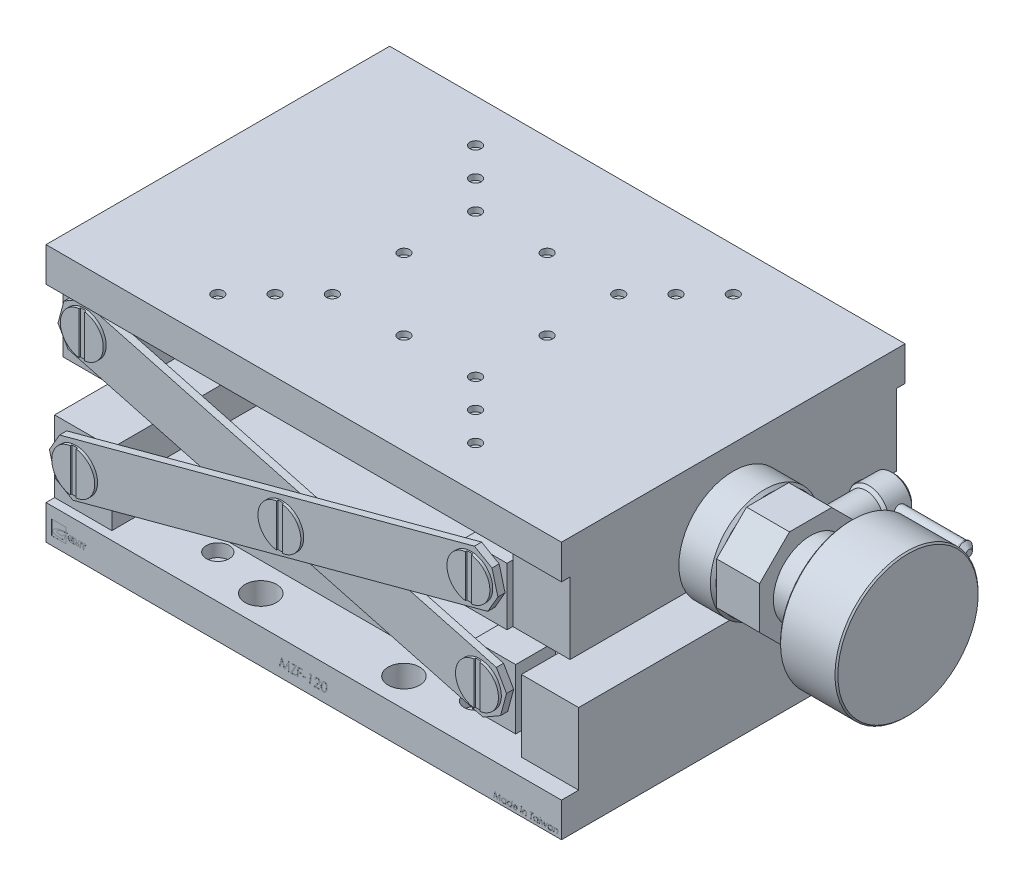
SolidWorks part; units mm, degrees
ref_plane "Front Plane" through (0, 0, 0) normal (0, 0, 1) x (1, 0, 0)
ref_plane "Top Plane" through (0, 0, 0) normal (0, 1, 0) x (1, 0, 0)
ref_plane "Right Plane" through (0, 0, 0) normal (1, 0, 0) x (0, 0, -1)
sketch "Sketch2" plane through (0, 0, 0) normal (0, 0, 1) x (1, 0, 0)
  line L0 (-90, 0) -> (90, 0)
  line L1 (90, 0) -> (90, 12)
  line L4 (90, 12) -> (-90, 12)
  line L7 (-90, 12) -> (-90, 0)
  line L8 (0, 0) -> (0, 56.6665) construction
  dimension "D2" = 12
  dimension "D3" = 180
extrude "Extrude1" add sketch "Sketch2" along normal mid plane 120
sketch "Sketch3" plane through (0, 0, 0) normal (0, 0, 1) x (1, 0, 0)
  line L0 (-90, 90) -> (90, 90)
  line L1 (-90, 90) -> (-90, 78)
  line L2 (-90, 78) -> (90, 78)
  line L7 (90, 78) -> (90, 90)
  line L8 (0, 0) -> (0, 61.872) construction
  line L9 (-90, 12) -> (-90, 0) construction
  dimension "D1" = 12
  dimension "D3" = 90
extrude "Extrude2" add sketch "Sketch3" along normal mid plane 120 separate body
sketch "Sketch5" plane through (0, 0, 0) normal (0, 0, 1) x (1, 0, 0)
  line L0 (-90, 78) -> (90, 78) construction
  line L5 (90, 12) -> (-90, 12) construction
  line L6 (90, 78) -> (90, 90) construction
  line L7 (70, 78) -> (90, 78)
  line L8 (70, 78) -> (70, 53)
  line L9 (70, 53) -> (90, 53)
  line L10 (0, 0) -> (0, 91.9874) construction
  line L11 (90, 78) -> (90, 53)
  line L12 (-90, 12) -> (-90, 0) construction
  line L15 (-90, 37) -> (-90, 12)
  line L16 (-70, 12) -> (-90, 12)
  line L17 (-70, 37) -> (-70, 12)
  line L22 (-70, 37) -> (-90, 37)
  dimension "D1" = 20
  dimension "D2" = 25
  dimension "D3" = 20
  dimension "D4" = 25
extrude "Extrude3" add sketch "Sketch5" against normal mid plane 114
ref_plane "Plane3" through (0, 0, 25) normal (0, 0, 1) x (1, 0, 0)
ref_plane "Plane4" through (0, 0, 35) normal (0, 0, 1) x (1, 0, 0)
sketch "Sketch31" plane through (0, 0, 0) normal (0, 0, 1) x (1, 0, 0)
  line L0 (70, 62.5) -> (116.0682, 62.5) construction
  line L1 (90, 78) -> (90, 90) construction
  line L2 (90, 78) -> (90, 90) construction
  line L3 (90, 90) -> (-90, 90) construction
  line L4 (102, 72) -> (117, 72)
  line L5 (90, 53) -> (90, 78) construction
  line L6 (117, 72) -> (117, 75.5)
  line L7 (117, 75.5) -> (131, 75.5)
  line L8 (131, 75.5) -> (131, 87.5)
  line L9 (131, 87.5) -> (151, 87.5)
  line L10 (151, 87.5) -> (151, 62.5)
  line L12 (90, 62.5) -> (151, 62.5)
  line L14 (90, 81.5) -> (102, 81.5)
  line L15 (90, 81.5) -> (90, 62.5)
  line L17 (102, 81.5) -> (102, 72)
  dimension "D1" = 27.5
  dimension "D2" = 50
  dimension "D3" = 20
  dimension "D4" = 61
  dimension "D5" = 14
  dimension "D6" = 19
  dimension "D7" = 26
  dimension "D8" = 12
  dimension "D9" = 19
revolve "Revolve2" add sketch "Sketch31" angle 360 about L0
chamfer "Chamfer4" distance 0.5 angle 45 2 edges at (131, 62.5, 25) (151, 62.5, 25)
chamfer "Chamfer" distance 1 angle 45 1 edges at (102, 62.5, 19)
ref_plane "Plane5" through (0, 72.5, 0) normal (0, 1, 0) x (-1, 0, 0)
ref_plane "Plane6" through (107, 0, 0) normal (1, 0, 0) x (0, 0, -1)
sketch "Sketch36" plane through (0, 0, 0) normal (0, 0, 1) x (1, 0, 0)
  line L0 (-90, 78) -> (90, 78) construction
  line L1 (-90, 78) -> (-70, 78)
  line L2 (-90, 78) -> (-90, 53)
  line L3 (-90, 53) -> (-70, 53)
  line L4 (-70, 78) -> (-70, 53)
  line L5 (90, 12) -> (70, 12)
  line L6 (90, 12) -> (90, 37)
  line L7 (90, 37) -> (70, 37)
  line L8 (70, 12) -> (70, 37)
  line L9 (90, 12) -> (-90, 12) construction
  dimension "D1" = 20
  dimension "D2" = 25
  dimension "D3" = 25
  dimension "D4" = 20
extrude "Extrude4" add sketch "Sketch36" along normal mid plane 108
sketch "Sketch37" plane through (0, 0, 0) normal (0, 0, 1) x (1, 0, 0)
  line L0 (-70, 53) -> (-70, 78) construction
  line L1 (-70, 65.5) -> (70, 65.5)
  line L2 (-70, 65.5) -> (-70, 78)
  line L3 (-70, 78) -> (70, 78)
  line L4 (70, 65.5) -> (70, 78)
  line L5 (-70, 12) -> (-70, 37) construction
  line L6 (-70, 24.5) -> (70, 24.5)
  line L7 (-70, 24.5) -> (-70, 12)
  line L8 (-70, 12) -> (70, 12)
  line L9 (70, 24.5) -> (70, 12)
  line L10 (90, 12) -> (-90, 12) construction
  line L11 (70, 37) -> (70, 12) construction
extrude "Extrude5" add sketch "Sketch37" along normal mid plane 80
sketch "Sketch38" plane through (0, 0, 25) normal (0, 0, 1) x (1, 0, 0)
  line L0 (25, 102.4031) -> (25, 51.2244) construction
  line L1 (27, 90) -> (27, 88)
  line L2 (90, 90) -> (-90, 90) construction
  line L3 (27, 88) -> (25, 88)
  line L4 (27, 90) -> (25, 90)
  line L5 (25, 90) -> (25, 88)
  dimension "D1" = 25
  dimension "D2" = 2
  dimension "D3" = 4
revolve "Cut-Revolve1" cut sketch "Sketch38" angle 360 about L0
pattern_linear "LPattern1" count 3 spacing 25 along (-1, 0, 0) count 3 spacing 25 along (0, 0, -1) of "Cut-Revolve1"
sketch "Sketch39" plane through (0, 0, 35) normal (0, 0, 1) x (1, 0, 0)
  line L0 (35, 131.6916) -> (35, 44.3084) construction
  line L1 (37, 90) -> (37, 88)
  line L2 (90, 90) -> (-90, 90) construction
  line L3 (37, 88) -> (35, 88)
  line L4 (35, 88) -> (35, 90)
  line L5 (35, 90) -> (37, 90)
  dimension "D1" = 35
  dimension "D2" = 2
  dimension "D3" = 4
revolve "Cut-Revolve2" cut sketch "Sketch39" angle 360 about L0
pattern_linear "LPattern2" count 2 spacing 70 along (0, 0, -1) count 2 spacing 70 along (-1, 0, 0) of "Cut-Revolve2"
ref_plane "Plane7" through (0, 0, 45) normal (0, 0, 1) x (1, 0, 0)
sketch "Sketch40" plane through (0, 0, 45) normal (0, 0, 1) x (1, 0, 0)
  line L0 (45, 116.5119) -> (45, 54.8208) construction
  line L1 (45, 90) -> (47, 90)
  line L2 (90, 90) -> (-90, 90) construction
  line L3 (47, 90) -> (47, 88)
  line L4 (47, 88) -> (45, 88)
  line L5 (45, 88) -> (45, 90)
  dimension "D1" = 45
  dimension "D2" = 2
  dimension "D3" = 4
revolve "Cut-Revolve3" cut sketch "Sketch40" angle 360 about L0
pattern_linear "LPattern3" count 2 spacing 90 along (0, 0, -1) count 2 spacing 90 along (-1, 0, 0) of "Cut-Revolve3"
ref_plane "Plane9" through (0, 0, 50) normal (0, 0, 1) x (1, 0, 0)
sketch "Sketch42" plane through (0, 0, 0) normal (0, 0, 1) x (1, 0, 0)
  line L0 (75, 111.2557) -> (75, -23.1922) construction
  line L1 (80.5, 12) -> (80.5, 3.5)
  line L2 (90, 12) -> (-90, 12) construction
  line L3 (80.5, 3.5) -> (78.5, 3.5)
  line L4 (78.5, 3.5) -> (78.5, 0)
  line L5 (-90, 0) -> (90, 0) construction
  line L6 (78.5, 0) -> (75, 0)
  line L7 (75, 0) -> (75, 12)
  line L8 (75, 12) -> (80.5, 12)
  line L9 (90, 12) -> (90, 37) construction
  dimension "D1" = 15
  dimension "D2" = 3.5
  dimension "D3" = 7
  dimension "D4" = 11
revolve "Cut-Revolve4" cut sketch "Sketch42" angle 360 about L0
pattern_linear "LPattern4" count 4 spacing 50 along (-1, 0, 0) count 2 spacing 50 of "Cut-Revolve4"
pattern_linear "LPattern5" count 2 spacing 50 along (1, 0, 0) count 3 spacing 50 along (-1, 0, 0) of "Cut-Revolve4"
sketch "Sketch43" plane through (0, 0, 45) normal (0, 0, 1) x (1, 0, 0)
  line L0 (45, 111.6861) -> (45, -36.0272) construction
  line L1 (49, 12) -> (49, 7.5)
  line L2 (90, 12) -> (-90, 12) construction
  line L3 (49, 7.5) -> (47.25, 7.5)
  line L4 (47.25, 7.5) -> (47.25, 0)
  line L5 (-90, 0) -> (90, 0) construction
  line L6 (47.25, 0) -> (45, 0)
  line L7 (45, 0) -> (45, 12)
  line L8 (45, 12) -> (49, 12)
  dimension "D1" = 45
  dimension "D2" = 7.5
  dimension "D3" = 8
  dimension "D4" = 2.25
revolve "Cut-Revolve5" cut sketch "Sketch43" angle 360 about L0
pattern_linear "LPattern6" count 2 spacing 90 along (0, 0, -1) count 2 spacing 90 along (-1, 0, 0) of "Cut-Revolve5"
sketch "Sketch44" plane through (102, 0, 0) normal (1, 0, 0) x (0, 0, -1)
  line L0 (0, 62.5) -> (20.571, 62.5) construction
  line L1 (20.571, 62.5) -> (10.2855, 80.315) construction
  line L2 (10.2855, 80.315) -> (-10.2855, 80.315) construction
  line L3 (-10.2855, 80.315) -> (-20.571, 62.5) construction
  line L4 (-20.571, 62.5) -> (-10.2855, 44.685) construction
  line L5 (-10.2855, 44.685) -> (10.2855, 44.685) construction
  line L6 (10.2855, 44.685) -> (20.571, 62.5) construction
  line L8 (7.3792, 80.315) -> (-7.3792, 80.315)
  line L9 (-7.3792, 80.315) -> (-17.815, 69.8792)
  line L10 (-17.815, 69.8792) -> (-17.815, 55.1208)
  line L11 (-17.815, 55.1208) -> (-7.3792, 44.685)
  line L12 (-7.3792, 44.685) -> (7.3792, 44.685)
  line L13 (7.3792, 44.685) -> (17.815, 55.1208)
  line L14 (17.815, 55.1208) -> (17.815, 69.8792)
  line L15 (17.815, 69.8792) -> (7.3792, 80.315)
  circle A0 centre (0, 62.5) radius 17.815 construction
  circle A1 centre (0, 62.5) radius 24.5 construction
  circle A2 centre (0, 62.5) radius 9.5 construction
  circle A3 centre (0, 62.5) radius 9.5
  circle A4 centre (0, 62.5) radius 17.815 construction
  dimension "D1" = 35.63
extrude "Extrude6" add sketch "Sketch44" along normal blind 15
sketch "Sketch45" plane through (0, 0, 40) normal (0, 0, 1) x (1, 0, 0)
  line L0 (70, 37) -> (70, 12) construction
  line L1 (53, 39) -> (68, 39)
  line L2 (53, 39) -> (53, 18)
  line L3 (53, 18) -> (68, 18)
  line L4 (68, 39) -> (68, 18)
  line L5 (90, 12) -> (-90, 12) construction
  line L6 (90, 37) -> (70, 37) construction
  dimension "D1" = 2
  dimension "D2" = 6
  dimension "D3" = 2
  dimension "D4" = 15
extrude "Extrude7" add sketch "Sketch45" along normal blind 14
mirror "Mirror1" about plane through (0, 0, 0) normal (0, 0, 1) of "Extrude7"
sketch "Sketch46" plane through (0, 0, 54) normal (0, 0, 1) x (1, 0, 0)
  line L0 (-11, 48) -> (-11, -18.5173) construction
  line L1 (-90, 78) -> (-90, 53) construction
  line L2 (-98.0547, 71.3262) -> (82.97, 22.8208) construction
  line L3 (90, 12) -> (-90, 12) construction
  line L4 (-85.9447, 77.3989) -> (68.6034, 35.9878)
  line L5 (63.9447, 18.6011) -> (-90.6034, 60.0122)
  line L6 (-90.6034, 60.0122) -> (-85.9447, 77.3989)
  line L7 (63.9447, 18.6011) -> (68.6034, 35.9878)
  dimension "D1" = 79
  dimension "D2" = 15
  dimension "D3" = 48
  dimension "D4" = 18
  dimension "D5" = 80
  dimension "D6" = 80
extrude "Extrude8" add sketch "Sketch46" along normal blind 2.5 separate body
chamfer "Chamfer5" distance 5 angle 45 4 edges at (-85.9447, 77.3989, 55.25) (-90.6034, 60.0122, 55.25) (63.9447, 18.6011, 55.25) (68.6034, 35.9878, 55.25)
sketch "Sketch47" plane through (0, 0, -54) normal (0, 0, -1) x (-1, 0, 0)
  line L5 (89.3093, 64.8418) -> (87.2388, 72.5692)
  line L6 (89.3093, 64.8418) -> (87.2388, 72.5692)
  line L7 (87.2388, 72.5692) -> (81.1151, 76.1048)
  line L8 (87.2388, 72.5692) -> (81.1151, 76.1048)
  line L9 (81.1151, 76.1048) -> (-63.7738, 37.2819)
  line L10 (81.1151, 76.1048) -> (-63.7738, 37.2819)
  line L11 (-63.7738, 37.2819) -> (-67.3093, 31.1582)
  line L12 (-63.7738, 37.2819) -> (-67.3093, 31.1582)
  line L13 (-67.3093, 31.1582) -> (-65.2388, 23.4308)
  line L14 (-67.3093, 31.1582) -> (-65.2388, 23.4308)
  line L18 (-65.2388, 23.4308) -> (-59.1151, 19.8952)
  line L19 (-65.2388, 23.4308) -> (-59.1151, 19.8952)
  line L20 (-59.1151, 19.8952) -> (85.7738, 58.7181)
  line L21 (-59.1151, 19.8952) -> (85.7738, 58.7181)
  line L22 (85.7738, 58.7181) -> (89.3093, 64.8418)
  line L23 (85.7738, 58.7181) -> (89.3093, 64.8418)
  dimension "D1" = 0
extrude "Extrude9" add sketch "Sketch47" along normal blind 2
sketch "Sketch48" plane through (0, 0, 40) normal (0, 0, 1) x (1, 0, 0)
  line L1 (53, 71.1213) -> (68, 71.1213)
  line L2 (53, 71.1213) -> (53, 51)
  line L3 (53, 51) -> (68, 51)
  line L4 (68, 71.1213) -> (68, 51)
  line L5 (70, 78) -> (70, 53) construction
  line L6 (70, 53) -> (90, 53) construction
  dimension "D1" = 20.1213
  dimension "D2" = 2
  dimension "D3" = 15
  dimension "D4" = 2
extrude "Extrude10" add sketch "Sketch48" along normal blind 17
mirror "Mirror3" about plane through (0, 0, 0) normal (0, 0, 1) of "Extrude10"
sketch "Sketch49" plane through (0, 0, 57) normal (0, 0, 1) x (1, 0, 0)
  line L0 (-11, 45) -> (-11, -32.2112) construction
  line L1 (-90, 37) -> (-90, 12) construction
  line L2 (-110.7533, 18.2712) -> (100.6797, 74.9245) construction
  line L3 (90, 12) -> (-90, 12) construction
  line L4 (63.9447, 74.3989) -> (-90.6034, 32.9878)
  line L5 (-90.6034, 32.9878) -> (-85.9447, 15.6011)
  line L6 (-85.9447, 15.6011) -> (68.6034, 57.0122)
  line L7 (68.6034, 57.0122) -> (63.9447, 74.3989)
  dimension "D1" = 79
  dimension "D2" = 15
  dimension "D3" = 45
  dimension "D4" = 18
  dimension "D5" = 80
  dimension "D6" = 80
extrude "Extrude11" add sketch "Sketch49" along normal blind 2.5 separate body
chamfer "Chamfer6" distance 5 angle 45 4 edges at (-90.6034, 32.9878, 58.25) (-85.9447, 15.6011, 58.25) (63.9447, 74.3989, 58.25) (68.6034, 57.0122, 58.25)
sketch "Sketch50" plane through (0, 0, -57) normal (0, 0, -1) x (-1, 0, 0)
  line L8 (87.2388, 20.4308) -> (89.3093, 28.1582)
  line L9 (89.3093, 28.1582) -> (85.7738, 34.2819)
  line L10 (85.7738, 34.2819) -> (-59.1151, 73.1048)
  line L11 (-59.1151, 73.1048) -> (-65.2388, 69.5692)
  line L12 (-65.2388, 69.5692) -> (-67.3093, 61.8418)
  line L13 (-67.3093, 61.8418) -> (-63.7738, 55.7181)
  line L14 (-63.7738, 55.7181) -> (81.1151, 16.8952)
  line L15 (81.1151, 16.8952) -> (87.2388, 20.4308)
  line L16 (87.2388, 20.4308) -> (89.3093, 28.1582)
  line L17 (89.3093, 28.1582) -> (85.7738, 34.2819)
  line L18 (85.7738, 34.2819) -> (-59.1151, 73.1048)
  line L19 (-59.1151, 73.1048) -> (-65.2388, 69.5692)
  line L20 (-65.2388, 69.5692) -> (-67.3093, 61.8418)
  line L21 (-67.3093, 61.8418) -> (-63.7738, 55.7181)
  line L22 (-63.7738, 55.7181) -> (81.1151, 16.8952)
  line L23 (81.1151, 16.8952) -> (87.2388, 20.4308)
  dimension "D1" = 0
extrude "Extrude12" add sketch "Sketch50" along normal blind 3
sketch "Sketch51" plane through (0, 0, 59.5) normal (0, 0, 1) x (1, 0, 0)
  line L0 (-95.793, 22.2798) -> (77.4995, 68.7134) construction
  line L1 (-81.1151, 16.8952) -> (63.7738, 55.7181) construction
  line L2 (59.1151, 73.1048) -> (-85.7738, 34.2819) construction
  line L4 (-8, 45.8038) -> (-8, -8.0062) construction
  line L5 (-90, 12) -> (-90, 0) construction
  circle A0 centre (-80, 26.5115) radius 7.5
  circle A1 centre (-8, 45.8038) radius 7.5
  circle A2 centre (58, 63.4885) radius 7.5
  dimension "D1" = 15
  dimension "D2" = 82
  dimension "D3" = 72
  dimension "D4" = 66
extrude "Extrude13" add sketch "Sketch51" along normal blind 1
sketch "Sketch52" plane through (0, 0, 56.5) normal (0, 0, 1) x (1, 0, 0)
  line L0 (-99.4418, 71.6979) -> (77.5779, 24.2656) construction
  line L1 (63.7738, 37.2819) -> (-81.1151, 76.1048) construction
  line L2 (-85.7738, 58.7181) -> (59.1151, 19.8952) construction
  circle A0 centre (-80, 66.4885) radius 7.5
  circle A1 centre (58, 29.5115) radius 7.5
  dimension "D1" = 15
  dimension "D2" = 80
  dimension "D3" = 58
extrude "Extrude14" add sketch "Sketch52" along normal blind 1
sketch "Sketch53" plane through (0, 0, 60.5) normal (0, 0, 1) x (1, 0, 0)
  line L0 (-81, 33.9445) -> (-81, 19.0785)
  line L1 (-79, 33.9445) -> (-79, 19.0785)
  line L2 (-9, 53.2369) -> (-9, 38.3708)
  line L3 (-7, 53.2369) -> (-7, 38.3708)
  line L4 (57, 70.9215) -> (57, 56.0555)
  line L5 (59, 70.9215) -> (59, 56.0555)
  line L6 (-80, 26.5115) -> (-80, -3.5379) construction
  line L7 (-8, 45.8038) -> (-8, 6.5675) construction
  line L8 (58, 63.4885) -> (58, -6.0205) construction
  circle A0 centre (-8, 45.8038) radius 7.5 construction
  circle A1 centre (-80, 26.5115) radius 7.5
  arc A2 (-79, 33.9445) -> (-81, 33.9445) centre (-80, 26.5115) ccw
  arc A3 (-7, 53.2369) -> (-9, 53.2369) centre (-8, 45.8038) ccw
  arc A4 (-9, 38.3708) -> (-7, 38.3708) centre (-8, 45.8038) ccw
  circle A5 centre (58, 63.4885) radius 7.5
  arc A6 (57, 56.0555) -> (59, 56.0555) centre (58, 63.4885) ccw
  arc A7 (59, 70.9215) -> (57, 70.9215) centre (58, 63.4885) ccw
  arc A8 (-81, 19.0785) -> (-79, 19.0785) centre (-80, 26.5115) ccw
  dimension "D3" = 2
  dimension "D4" = 2
  dimension "D5" = 2
  dimension "D1" = 0
  dimension "D2" = 0
extrude "Cut-Extrude1" cut sketch "Sketch53" against normal blind 0.5
sketch "Sketch54" plane through (0, 0, 57.5) normal (0, 0, 1) x (1, 0, 0)
  line L0 (-80, 66.4885) -> (-80, 40.9457) construction
  line L1 (58, 29.5115) -> (58, -6.5046) construction
  line L2 (-81, 73.9215) -> (-81, 59.0555)
  line L5 (-79, 73.9215) -> (-79, 59.0555)
  line L6 (57, 36.9445) -> (57, 22.0785)
  line L7 (59, 36.9445) -> (59, 22.0785)
  arc A0 (-81, 59.0555) -> (-79, 59.0555) centre (-80, 66.4885) ccw
  circle A1 centre (58, 29.5115) radius 7.5
  arc A2 (59, 36.9445) -> (57, 36.9445) centre (58, 29.5115) ccw
  circle A3 centre (-80, 66.4885) radius 7.5
  arc A4 (-79, 73.9215) -> (-81, 73.9215) centre (-80, 66.4885) ccw
  arc A5 (57, 22.0785) -> (59, 22.0785) centre (58, 29.5115) ccw
  dimension "D3" = 2
  dimension "D4" = 2
  dimension "D1" = 0
  dimension "D2" = 0
extrude "Cut-Extrude2" cut sketch "Sketch54" against normal blind 0.5
sketch "Sketch55" plane through (0, 0, -60) normal (0, 0, -1) x (-1, 0, 0)
  circle A0 centre (80, 26.5115) radius 7.5 construction
  circle A1 centre (8, 45.8038) radius 7.5 construction
  circle A2 centre (-58, 63.4885) radius 7.5 construction
  circle A3 centre (80, 26.5115) radius 7.5
  circle A4 centre (8, 45.8038) radius 7.5
  circle A5 centre (-58, 63.4885) radius 7.5
extrude "Extrude15" add sketch "Sketch55" along normal blind 1
sketch "Sketch56" plane through (0, 0, -56) normal (0, 0, -1) x (-1, 0, 0)
  circle A0 centre (80, 66.4885) radius 7.5 construction
  circle A1 centre (-58, 29.5115) radius 7.5 construction
  circle A2 centre (80, 66.4885) radius 7.5
  circle A3 centre (-58, 29.5115) radius 7.5
extrude "Extrude16" add sketch "Sketch56" along normal blind 1
sketch "Sketch57" plane through (0, 0, -61) normal (0, 0, -1) x (-1, 0, 0)
  line L0 (81, 33.9445) -> (81, 19.0785) construction
  line L1 (79, 19.0785) -> (79, 33.9445) construction
  line L2 (9, 53.2369) -> (9, 38.3708) construction
  line L3 (7, 38.3708) -> (7, 53.2369) construction
  line L4 (-57, 70.9215) -> (-57, 56.0555) construction
  line L5 (-59, 56.0555) -> (-59, 70.9215) construction
  line L6 (81, 33.9445) -> (81, 19.0785)
  line L7 (79, 19.0785) -> (79, 33.9445)
  line L8 (9, 53.2369) -> (9, 38.3708)
  line L9 (7, 38.3708) -> (7, 53.2369)
  line L10 (-57, 70.9215) -> (-57, 56.0555)
  line L11 (-59, 56.0555) -> (-59, 70.9215)
  circle A0 centre (-58, 63.4885) radius 7.5 construction
  arc A1 (-57, 70.9215) -> (-59, 70.9215) centre (-58, 63.4885) ccw
  circle A2 centre (8, 45.8038) radius 7.5 construction
  arc A3 (9, 53.2369) -> (7, 53.2369) centre (8, 45.8038) ccw
  circle A4 centre (80, 26.5115) radius 7.5 construction
  arc A5 (79, 19.0785) -> (81, 19.0785) centre (80, 26.5115) ccw
  arc A6 (-59, 56.0555) -> (-57, 56.0555) centre (-58, 63.4885) ccw
  arc A7 (7, 38.3708) -> (9, 38.3708) centre (8, 45.8038) ccw
  arc A8 (81, 33.9445) -> (79, 33.9445) centre (80, 26.5115) ccw
extrude "Cut-Extrude3" cut sketch "Sketch57" against normal blind 0.5
sketch "Sketch58" plane through (0, 0, -57) normal (0, 0, -1) x (-1, 0, 0)
  line L0 (79, 59.0555) -> (79, 73.9215) construction
  line L1 (81, 73.9215) -> (81, 59.0555) construction
  line L2 (-59, 22.0785) -> (-59, 36.9445) construction
  line L3 (-57, 36.9445) -> (-57, 22.0785) construction
  line L4 (79, 59.0555) -> (79, 73.9215)
  line L5 (81, 73.9215) -> (81, 59.0555)
  line L6 (-59, 22.0785) -> (-59, 36.9445)
  line L7 (-57, 36.9445) -> (-57, 22.0785)
  circle A0 centre (-58, 29.5115) radius 7.5 construction
  arc A1 (-57, 36.9445) -> (-59, 36.9445) centre (-58, 29.5115) ccw
  circle A2 centre (80, 66.4885) radius 7.5 construction
  arc A3 (79, 59.0555) -> (81, 59.0555) centre (80, 66.4885) ccw
  arc A4 (-59, 22.0785) -> (-57, 22.0785) centre (-58, 29.5115) ccw
  arc A5 (81, 73.9215) -> (79, 73.9215) centre (80, 66.4885) ccw
extrude "Cut-Extrude4" cut sketch "Sketch58" against normal blind 0.5
ref_plane "Plane10" through (0, 65, 0) normal (0, 1, 0) x (-1, 0, 0)
sketch "Sketch59" plane through (0, 65, 0) normal (0, 1, 0) x (-1, 0, 0)
  line L0 (-108.5, 35.3377) -> (-108.5, -77.8823) construction
  line L1 (-90, 60) -> (-90, -60) construction
  line L2 (-108.5, -37.815) -> (-115.5, -37.815)
  line L3 (-115.5, -37.815) -> (-115.5, -27.815)
  line L4 (-115.5, -27.815) -> (-114.5, -27.815)
  line L5 (-114.5, -27.815) -> (-114.5, 0)
  line L7 (-114.5, 0) -> (-108.5, 0)
  line L8 (-108.5, 0) -> (-108.5, -37.815)
  line L10 (0, 0) -> (-171.4523, 0) construction
  line L12 (-117, -17.815) -> (-102, -17.815) construction
  dimension "D1" = 18.5
  dimension "D2" = 12
  dimension "D3" = 14
  dimension "D4" = 10
  dimension "D5" = 20
revolve "Revolve3" add sketch "Sketch59" angle 360 about L0
ref_plane "Plane11" through (0, 0, -32.815) normal (0, 0, -1) x (-1, 0, 0)
sketch "Sketch60" plane through (0, 0, -32.815) normal (0, 0, -1) x (-1, 0, 0)
  line L0 (-160.0288, 65) -> (-95.7187, 65) construction
  line L1 (-90, 90) -> (90, 90) construction
  line L2 (-137.5, 67.5) -> (-137.5, 67.75)
  line L3 (-139.5, 65) -> (-99.5, 65)
  line L4 (-139.5, 65) -> (-139.5, 67.75)
  line L5 (-137.5, 67.5) -> (-101.4999, 67.5)
  line L6 (-99.5, 65) -> (-99.5, 67.75)
  line L7 (-137.5, 67.75) -> (-139.5, 67.75)
  line L8 (-101.4999, 67.5) -> (-101.4999, 67.75)
  line L9 (-101.4999, 67.75) -> (-99.5, 67.75)
  circle A1 centre (-108.5, 65) radius 7 construction
  dimension "D5" = 5.5
  dimension "D1" = 25
  dimension "D2" = 5
  dimension "D3" = 40
  dimension "D4" = 31
  dimension "D6" = 29
  dimension "D7" = 5.5
  dimension "D8" = 1.9999
revolve "Revolve4" add sketch "Sketch60" angle 360 about L0
chamfer "Chamfer7" distance 1.6 angle 45 2 edges at (99.5, 65, -35.565) (139.5, 65, -35.565)
chamfer "Chamfer8" distance 1 angle 45 2 edges at (115.5, 65, -37.815) (115.5, 65, -27.815)
sketch "草圖1" plane through (0, 0, 60) normal (0, 0, 1) x (1, 0, 0)
  line L0 (-88, 8.0036) -> (-88, 3)
  line L1 (-88, 3) -> (-83.0015, 3)
  line L2 (-83.0015, 3) -> (-83.0015, 6.3493)
  line L3 (-83.0015, 6.5224) -> (-83.0015, 8.0036)
  line L4 (-76.6591, 5.7617) -> (-76.6591, 4.2727)
  line L5 (-76.6591, 5.7617) -> (-76.1607, 5.7617)
  line L6 (-76.0044, 5.9181) -> (-76.0044, 6.2667)
  line L7 (-76.0044, 6.2667) -> (-77.8097, 6.2667)
  line L8 (-77.8097, 6.2667) -> (-77.8097, 5.7711)
  line L9 (-77.8097, 5.7711) -> (-77.1634, 5.7711)
  line L10 (-77.1634, 5.7711) -> (-77.1634, 4.4319)
  line L11 (-77.0084, 4.2755) -> (-76.6591, 4.2727)
  line L12 (-77.9459, 6.2667) -> (-78.5109, 6.2667)
  line L13 (-79.6798, 6.2667) -> (-80.2448, 6.2667)
  line L14 (-80.3747, 6.2667) -> (-81.4283, 6.2667)
  line L15 (-80.2448, 6.2667) -> (-80.2448, 4.2768)
  line L16 (-77.9459, 4.2768) -> (-78.2818, 4.2768)
  line L17 (-78.9492, 4.2768) -> (-79.2415, 4.2768)
  line L18 (-79.9089, 4.2768) -> (-80.2448, 4.2768)
  line L19 (-80.3856, 4.2768) -> (-81.4283, 4.2768)
  line L20 (-79.6798, 6.2667) -> (-79.0953, 4.9116)
  line L21 (-79.7525, 5.4338) -> (-79.7525, 4.4331)
  line L22 (-79.7525, 4.4331) -> (-79.7525, 5.4338)
  line L23 (-79.7525, 5.4338) -> (-79.2415, 4.2768)
  line L24 (-77.9459, 6.2667) -> (-77.9459, 4.2768)
  line L25 (-78.4382, 5.4338) -> (-78.4382, 4.4331)
  line L26 (-78.4382, 4.4331) -> (-78.4382, 5.4338)
  line L27 (-78.4382, 5.4338) -> (-78.9492, 4.2768)
  line L28 (-78.5109, 6.2667) -> (-79.0953, 4.9116)
  line L29 (-80.3856, 5.5022) -> (-81.3911, 5.5022)
  line L30 (-80.3856, 5.5022) -> (-80.3856, 4.2768)
  line L31 (-81.3911, 5.5022) -> (-81.3911, 5.234)
  line L32 (-80.8185, 5.0776) -> (-81.2347, 5.0776)
  line L33 (-80.8185, 5.0776) -> (-80.8185, 4.697)
  line L34 (-80.8185, 4.697) -> (-81.4283, 4.697)
  line L35 (-80.3747, 6.2667) -> (-80.3747, 6.018)
  line L36 (-81.4283, 5.8617) -> (-80.5311, 5.8617)
  line L37 (-83.8719, 3.7209) -> (-83.2458, 5.3115)
  line L38 (-83.2458, 5.3115) -> (-83.8099, 5.3111)
  line L39 (-83.8099, 5.3111) -> (-84.3385, 4.6316)
  line L40 (-82.4241, 6.5675) -> (-82.4241, 6.423)
  line L41 (-83.8719, 3.7209) -> (-85.3533, 3.7128)
  line L42 (-88, 8.0036) -> (-83.0015, 8.0036)
  line L45 (-90, 0) -> (90, 0) construction
  line L46 (-90, 12) -> (-90, 0) construction
  arc A0 (-76.1607, 5.7617) -> (-76.0044, 5.9181) centre (-76.1607, 5.9181) ccw
  arc A1 (-77.1634, 4.4319) -> (-77.0084, 4.2755) centre (-77.0071, 4.4319) ccw
  arc A2 (-79.9089, 4.2768) -> (-79.7525, 4.4331) centre (-79.9089, 4.4331) ccw
  arc A3 (-78.4382, 4.4331) -> (-78.2818, 4.2768) centre (-78.2818, 4.4331) ccw
  arc A4 (-81.3911, 5.234) -> (-81.2347, 5.0776) centre (-81.2347, 5.234) ccw
  arc A5 (-80.5311, 5.8617) -> (-80.3747, 6.018) centre (-80.5311, 6.018) ccw
  arc A6 (-81.4283, 5.8617) -> (-81.4283, 4.697) centre (-81.065, 5.2793) ccw
  arc A7 (-81.4283, 6.2667) -> (-81.4283, 4.2768) centre (-81.2584, 5.2717) ccw
  arc A8 (-85.0734, 4.659) -> (-84.3385, 4.6316) centre (-84.4165, 12.403) ccw
  arc A9 (-85.6749, 4.7392) -> (-85.0734, 4.659) centre (-85.0445, 7.1725) ccw
  arc A10 (-86.1427, 4.9307) -> (-85.6749, 4.7392) centre (-85.4497, 5.9563) ccw
  arc A11 (-86.2604, 5.1351) -> (-86.1427, 4.9307) centre (-86.0255, 5.1343) ccw
  arc A12 (-86.1862, 5.304) -> (-86.2604, 5.1351) centre (-85.9395, 5.0949) ccw
  arc A13 (-85.9345, 5.5274) -> (-86.1862, 5.304) centre (-85.3708, 4.6388) ccw
  arc A14 (-85.5945, 5.7126) -> (-85.9345, 5.5274) centre (-84.4881, 3.2763) ccw
  arc A15 (-85.5945, 5.7126) -> (-85.1724, 5.879) centre (-88.7997, 14.46) ccw
  arc A16 (-85.1724, 5.879) -> (-84.7942, 5.9919) centre (-94.0933, 36.4661) ccw
  arc A17 (-84.419, 6.0903) -> (-84.7942, 5.9919) centre (-84.0772, 4.0237) ccw
  arc A18 (-84.419, 6.0903) -> (-84.1048, 6.156) centre (-84.7872, 8.6383) ccw
  arc A19 (-83.7029, 6.2336) -> (-84.1048, 6.156) centre (-81.587, -5.7986) ccw
  arc A20 (-83.7029, 6.2336) -> (-83.323, 6.3016) centre (-84.0645, 9.35) ccw
  arc A21 (-83.323, 6.3016) -> (-82.9854, 6.3531) centre (-83.4525, 8.2804) ccw
  arc A22 (-82.6761, 6.3958) -> (-82.9854, 6.3531) centre (-79.367, -18.7217) ccw
  arc A23 (-82.4241, 6.423) -> (-82.6761, 6.3958) centre (-82.3571, 4.6207) ccw
  arc A24 (-85.3533, 3.7128) -> (-85.8501, 3.7565) centre (-89.761, -43.5391) ccw
  arc A25 (-86.4042, 3.8273) -> (-85.8501, 3.7565) centre (-85.1151, 11.718) ccw
  arc A26 (-87.1334, 4.0155) -> (-86.4042, 3.8273) centre (-85.5983, 8.456) ccw
  arc A27 (-87.6256, 4.3318) -> (-87.1334, 4.0155) centre (-86.5647, 5.4417) ccw
  arc A28 (-87.7522, 4.6306) -> (-87.6256, 4.3318) centre (-87.3553, 4.6226) ccw
  arc A29 (-87.5905, 5.0207) -> (-87.7522, 4.6306) centre (-87.0706, 4.5766) ccw
  arc A30 (-87.2107, 5.3933) -> (-87.5905, 5.0207) centre (-85.9985, 3.7779) ccw
  arc A31 (-86.7537, 5.6534) -> (-87.2107, 5.3933) centre (-84.1865, 0.61) ccw
  arc A32 (-86.3175, 5.851) -> (-86.7537, 5.6534) centre (-84.4491, 1.1487) ccw
  arc A33 (-86.0101, 5.9598) -> (-86.3175, 5.851) centre (-63.5075, -58.1469) ccw
  arc A34 (-85.5643, 6.0888) -> (-86.0101, 5.9598) centre (-84.6333, 2.0376) ccw
  arc A35 (-85.1009, 6.2062) -> (-85.5643, 6.0888) centre (-83.7628, -0.0513) ccw
  arc A36 (-84.6667, 6.2901) -> (-85.1009, 6.2062) centre (-82.3665, -6.7785) ccw
  arc A37 (-84.6667, 6.2901) -> (-84.2903, 6.3614) centre (-85.1891, 10.0739) ccw
  arc A38 (-83.9529, 6.409) -> (-84.2903, 6.3614) centre (-83.8537, 4.4848) ccw
  arc A39 (-83.5596, 6.4554) -> (-83.9529, 6.409) centre (-83.4041, 3.4452) ccw
  arc A40 (-83.2106, 6.5004) -> (-83.5596, 6.4554) centre (-82.9304, 2.9581) ccw
  arc A41 (-82.8894, 6.5319) -> (-83.2106, 6.5004) centre (-82.2741, -1.4062) ccw
  arc A42 (-83.0719, 6.5156) -> (-82.659, 6.5542) centre (-85.3536, 33.1541) ccw
  arc A43 (-82.4241, 6.5675) -> (-82.659, 6.5542) centre (-82.4499, 4.9445) ccw
  dimension "D1" = 3
  dimension "D2" = 2
extrude "除料-伸長1" cut sketch "草圖1" against normal blind 0.02
sketch "草圖2" plane through (0, 0, 60) normal (0, 0, 1) x (1, 0, 0)
  line L0 (-90, 12) -> (-90, 0) construction
  line L1 (-88, 8) -> (-83, 8)
  line L2 (-88, 8) -> (-88, 3)
  line L3 (-88, 3) -> (-83, 3)
  line L4 (-83, 8) -> (-83, 3)
  line L5 (-90, 0) -> (90, 0) construction
  dimension "D1" = 5
  dimension "D2" = 5
  dimension "D3" = 2
  dimension "D4" = 3
extrude "除料-伸長2" cut sketch "草圖2" against normal blind 0.01
sketch "草圖3" plane through (0, 0, 60) normal (0, 0, 1) x (1, 0, 0)
  line L0 (-21.2315, 3.2) -> (21.2315, 3.2) construction
  line L1 (0, 30.4917) -> (0, 0) construction
  line L2 (-90, 0) -> (90, 0) construction
  text T0 "<i>MZF-120</i>" font "Century Gothic" height in points 9
  dimension "D1" = 3.2
extrude "除料-伸長3" cut sketch "草圖3" against normal blind 0.02
sketch "草圖4" plane through (0, 0, 60) normal (0, 0, 1) x (1, 0, 0)
  line L0 (56.6983, 1) -> (89, 1) construction
  line L1 (90, 0) -> (90, 12) construction
  line L4 (-90, 0) -> (90, 0) construction
  text T0 "<i>Made in Taiwan</i>" font "Century Gothic" height in points 6
  dimension "D1" = 1
  dimension "D2" = 1
extrude "除料-伸長4" cut sketch "草圖4" against normal blind 0.02
